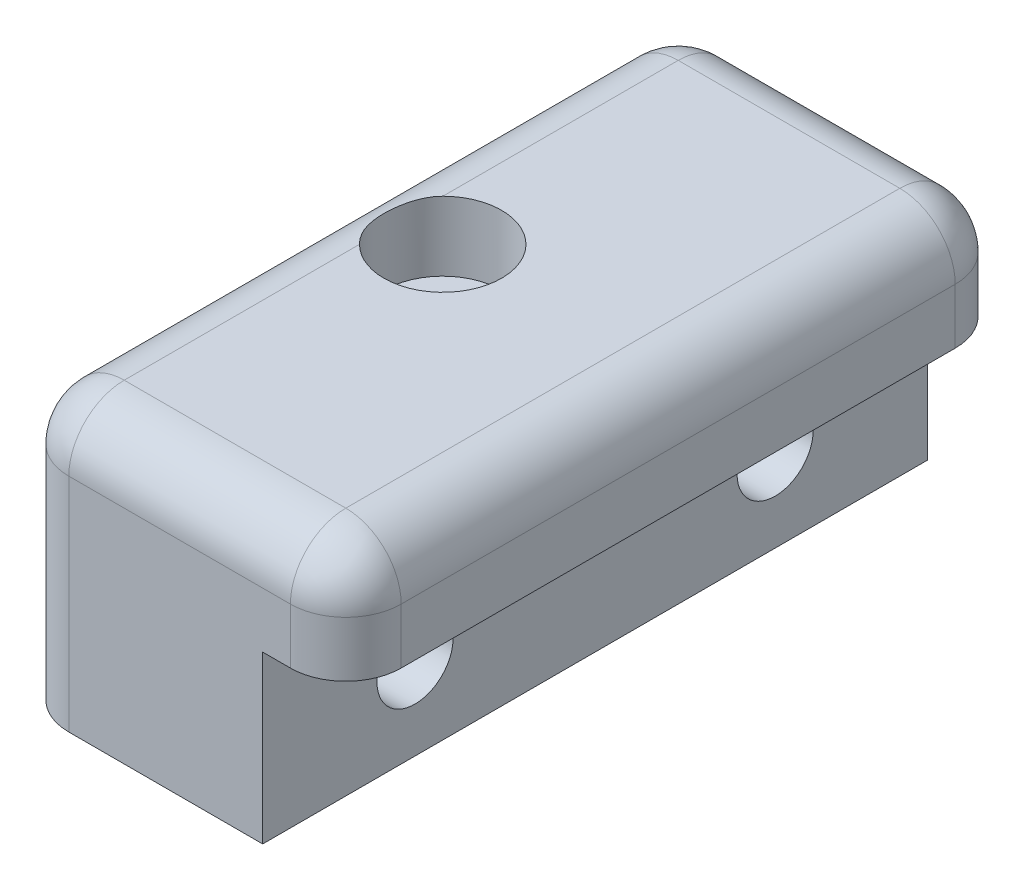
SolidWorks part; units mm, degrees
ref_plane "Front Plane" through (0, 0, 0) normal (0, 0, 1) x (1, 0, 0)
ref_plane "Top Plane" through (0, 0, 0) normal (0, 1, 0) x (1, 0, 0)
ref_plane "Right Plane" through (0, 0, 0) normal (1, 0, 0) x (0, 0, -1)
sketch "Sketch1" plane through (0, 0, 0) normal (1, 0, 0) x (0, 0, -1)
  line L1 (0, 0) -> (76.2, 0)
  line L2 (0, 0) -> (0, 31.75)
  line L3 (0, 31.75) -> (76.2, 31.75)
  line L4 (76.2, 0) -> (76.2, 31.75)
  dimension "D1" = 31.75
  dimension "D2" = 76.2
extrude "Boss-Extrude1" add sketch "Sketch1" along normal blind 38.1
sketch "Sketch2" plane through (0, 0, -76.2) normal (0, 0, -1) x (-1, 0, 0)
  line L0 (-38.1, 31.75) -> (0, 31.75) construction
  line L1 (-38.1, 0) -> (-28.575, 0)
  line L2 (-38.1, 0) -> (-38.1, 19.05)
  line L3 (-38.1, 19.05) -> (-28.575, 19.05)
  line L4 (-28.575, 0) -> (-28.575, 19.05)
  dimension "D1" = 12.7
  dimension "D2" = 9.525
extrude "Cut-Extrude1" cut sketch "Sketch2" against normal through all
hole_wizard "CBORE for 5/16 Socket Head Cap Screw1" positions "Sketch3" profile "Sketch4" counterbore size "5/16" standard "ANSI Inch"
sketch "Sketch3" plane through (0, 0, 0) normal (-1, 0, 0) x (0, 0, 1)
  line L0 (0, 0) -> (-76.2, 0) construction
  line L1 (-76.2, 0) -> (-76.2, 31.75) construction
  point P0 (-58.7375, 9.525)
  point P2 (-17.4625, 9.525)
  dimension "D1" = 9.525
  dimension "D2" = 9.525
  dimension "D3" = 41.275
  dimension "D4" = 17.4625
sketch "Sketch4" plane through (0, 9.525, -58.7375) normal (0, 1, 0) x (0, 0, 1)
  line L0 (0, 0) -> (0, 38.1)
  line L1 (0, 38.1) -> (4.365, 38.1)
  line L3 (4.365, 38.1) -> (4.365, 7.9375)
  line L4 (4.365, 7.9375) -> (6.7475, 7.9375)
  line L5 (6.7475, 7.9375) -> (6.7475, 0)
  line L7 (6.7475, 0) -> (0, 0)
  line L11 (0, -6.35) -> (0, 107.95) construction
  dimension "Thru Hole Dia." = 8.73
  dimension "Thru Hole Depth" = 38.1
  dimension "C'Bore Dia." = 13.495
  dimension "C'Bore Depth" = 7.9375
hole_wizard "CBORE for 5/16 Socket Head Cap Screw2" positions "Sketch5" profile "Sketch6" counterbore size "5/16" standard "ANSI Inch"
sketch "Sketch5" plane through (0, 31.75, 0) normal (0, 1, 0) x (1, 0, 0)
  line L0 (38.1, 76.2) -> (0, 76.2) construction
  line L1 (0, 76.2) -> (0, 0) construction
  point P0 (11.1125, 38.1)
  dimension "D1" = 38.1
  dimension "D2" = 11.1125
sketch "Sketch6" plane through (11.1125, 31.75, -38.1) normal (1, 0, 0) x (0, 0, 1)
  line L0 (0, 0) -> (0, 31.75)
  line L1 (0, 31.75) -> (4.365, 31.75)
  line L3 (4.365, 31.75) -> (4.365, 7.9375)
  line L4 (4.365, 7.9375) -> (6.7475, 7.9375)
  line L5 (6.7475, 7.9375) -> (6.7475, 0)
  line L7 (6.7475, 0) -> (0, 0)
  line L11 (0, -6.35) -> (0, 107.95) construction
  dimension "Thru Hole Dia." = 8.73
  dimension "Thru Hole Depth" = 31.75
  dimension "C'Bore Dia." = 13.495
  dimension "C'Bore Depth" = 7.9375
fillet "Fillet1" radius 6.35 8 edges at (19.05, 31.75, -76.2) (19.05, 31.75, 0) (38.1, 31.75, -38.1) (0, 31.75, -38.1) (38.1, 25.4, 0) (38.1, 25.4, -76.2) (0, 15.875, 0) (0, 15.875, -76.2)
